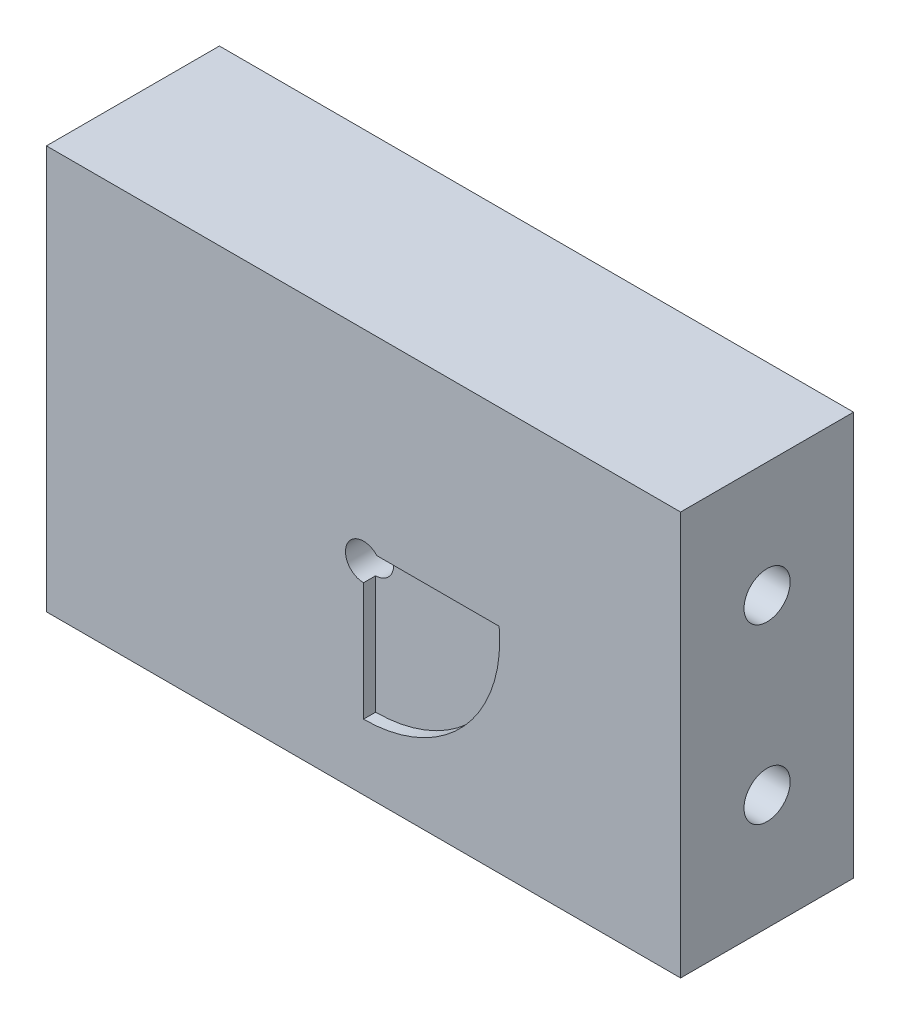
SolidWorks part; units mm, degrees
ref_plane "Plane1" through (0, 0, 0) normal (0, 0, 1) x (1, 0, 0)
ref_plane "Plane2" through (0, 0, 0) normal (0, 1, 0) x (1, 0, 0)
ref_plane "Plane3" through (0, 0, 0) normal (1, 0, 0) x (0, 0, -1)
imported_body "Imported1"
sketch "Sketch1" plane through (0, 0, 19.05) normal (0, 0, 1) x (1, 0, 0)
  line L0 (0, 2.667) -> (0, -30)
  line L2 (0, 2.667) -> (29.8812, 2.667)
  arc A0 (0, -30) -> (29.8812, 2.667) centre (0, 0) ccw
  circle A1 centre (0, 0) radius 3.9688 construction
  dimension "D1" = 60
  dimension "D2" = 2.667
extrude "Cut-Extrude1" cut sketch "Sketch1" against normal blind 2.667
sketch "Sketch2" plane through (0, 0, 19.05) normal (0, 0, 1) x (1, 0, 0)
  line L0 (2.9391, 0.254) -> (-29.7549, 0.254)
  line L1 (2.9391, 0.254) -> (2.9391, -29.6105)
  arc A0 (-29.7549, 0.254) -> (2.9391, -29.6105) centre (0, 0) ccw
  dimension "D1" = 0.254
extrude "Cut-Extrude2" [suppressed] cut sketch "Sketch2" against normal blind 2.667
